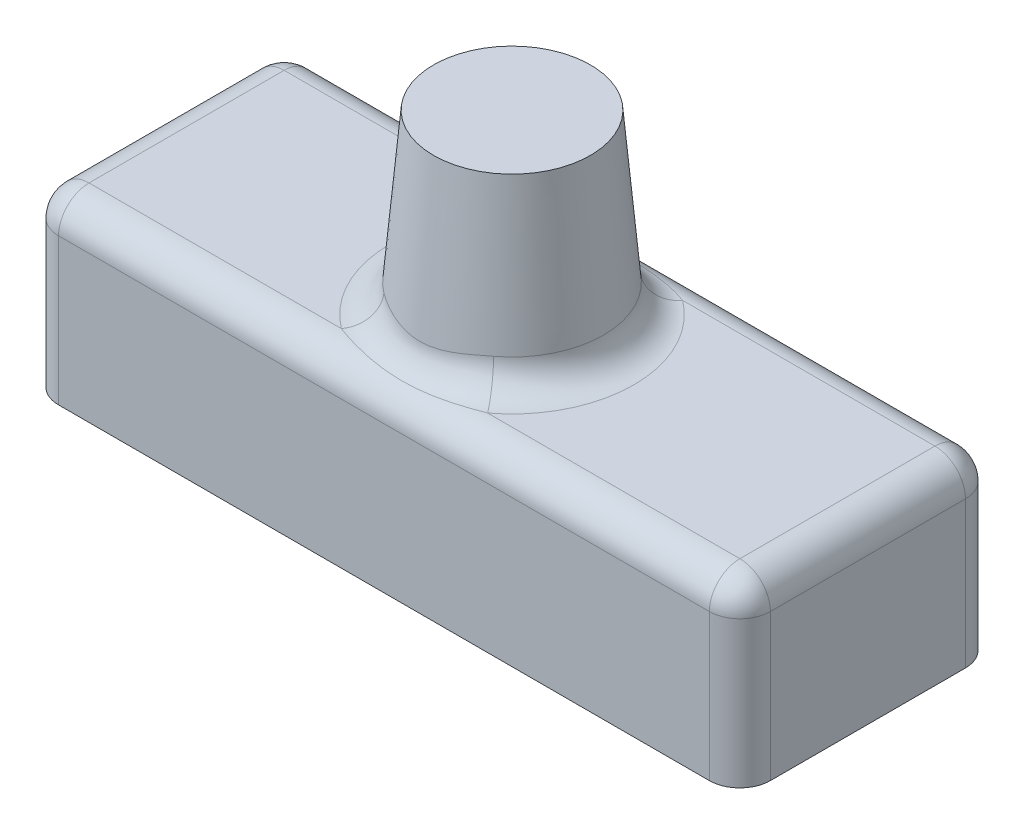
SolidWorks part; units mm, degrees
ref_plane "Front Plane" through (0, 0, 0) normal (0, 0, 1) x (1, 0, 0)
ref_plane "Top Plane" through (0, 0, 0) normal (0, 1, 0) x (1, 0, 0)
ref_plane "Right Plane" through (0, 0, 0) normal (1, 0, 0) x (0, 0, -1)
sketch "Sketch1" plane through (0, 0, 0) normal (0, 1, 0) x (1, 0, 0)
  line L0 (27.0853, -8.1181) -> (-27.0853, 8.1181) construction
  line L1 (-27.0853, -10.6581) -> (27.0853, -10.6581)
  line L2 (-29.6253, -8.1181) -> (-29.6253, 8.1181)
  line L3 (-27.0853, 10.6581) -> (27.0853, 10.6581)
  line L4 (29.6253, -8.1181) -> (29.6253, 8.1181)
  arc A0 (-29.6253, 8.1181) -> (-27.0853, 10.6581) centre (-27.0853, 8.1181) cw
  arc A1 (-27.0853, -10.6581) -> (-29.6253, -8.1181) centre (-27.0853, -8.1181) cw
  arc A2 (27.0853, 10.6581) -> (29.6253, 8.1181) centre (27.0853, 8.1181) cw
  arc A3 (27.0853, -10.6581) -> (29.6253, -8.1181) centre (27.0853, -8.1181) ccw
  point P8 (-29.6253, -10.6581)
  dimension "D1" = 2.54
extrude "Extrude1" add sketch "Sketch1" along normal blind 14.732
sketch "Sketch2" plane through (0, 14.732, 0) normal (0, 1, 0) x (1, 0, 0)
  line L0 (-27.0853, 8.1181) -> (27.0853, -8.1181) construction
  circle A0 centre (0, 0) radius 7.8184
extrude "Extrude2" add sketch "Sketch2" along normal blind 14.732 draft 5
fillet "Fillet3" radius 2.54 8 edges at (-28.8814, 14.732, 9.9142) (-29.6253, 14.732, 0) (-28.8814, 14.732, -9.9142) (0, 14.732, -10.6581) (28.8814, 14.732, -9.9142) (29.6253, 14.732, 0) (28.8814, 14.732, 9.9142) (0, 14.732, 10.6581)
fillet "Fillet4" radius 2.54 1 edges at (0, 14.732, -7.8184)
